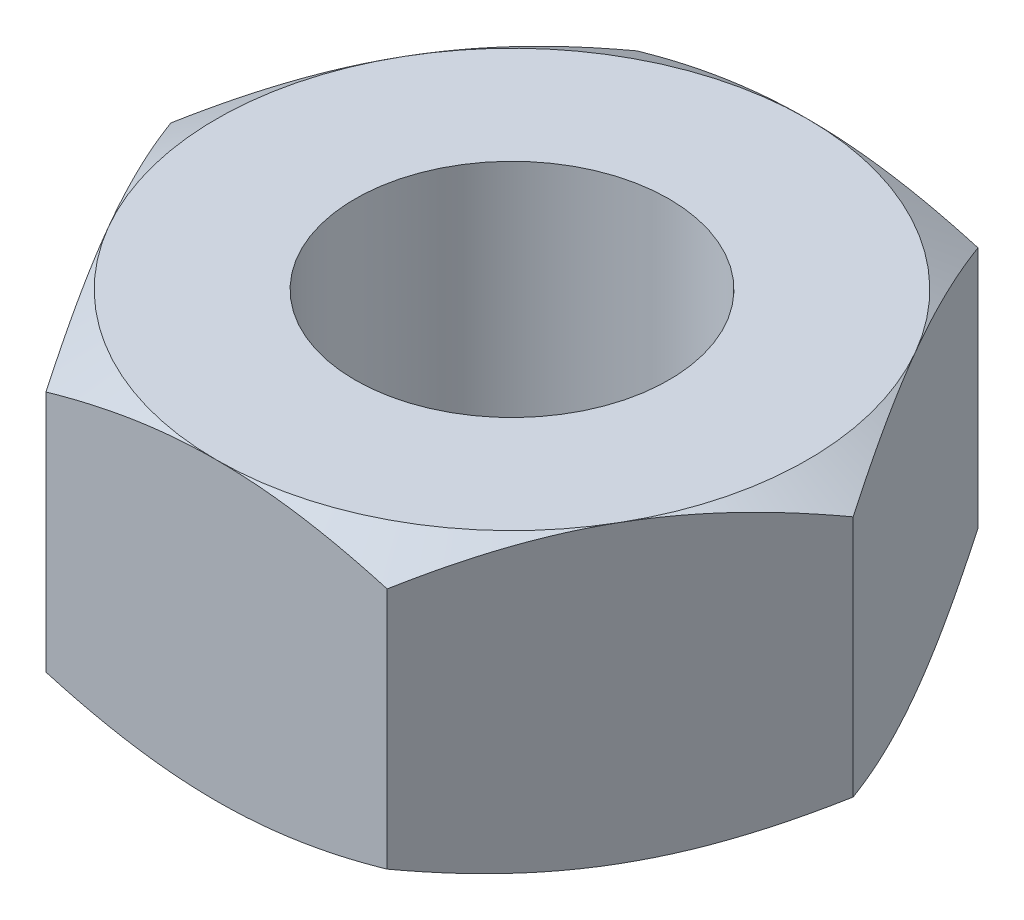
SolidWorks part; units mm, degrees
ref_plane "Front" through (0, 0, 0) normal (0, 0, 1) x (1, 0, 0)
ref_plane "Top" through (0, 0, 0) normal (0, 1, 0) x (1, 0, 0)
ref_plane "Right" through (0, 0, 0) normal (1, 0, 0) x (0, 0, -1)
sketch "Sketch1" plane through (0, 0, 0) normal (0, 1, 0) x (1, 0, 0)
  line L1 (9.2376, 0) -> (4.6188, 8)
  line L2 (4.6188, 8) -> (-4.6188, 8)
  line L3 (-4.6188, 8) -> (-9.2376, 0)
  line L4 (-9.2376, 0) -> (-4.6188, -8)
  line L5 (-4.6188, -8) -> (4.6188, -8)
  line L6 (4.6188, -8) -> (9.2376, 0)
  circle A0 centre (0, 0) radius 8 construction
  dimension "D1" = 16
extrude "Boss-Extrude1" add sketch "Sketch1" along normal blind 8
hole_wizard "M10x1.5 Tapped Hole1" positions "Sketch3" profile "Sketch4" tap size "M10x1.5" standard "ANSI Metric"
sketch "Sketch3" plane through (0, 8, 0) normal (0, 1, 0) x (1, 0, 0)
  point P0 (0, 0)
sketch "Sketch4" plane through (0, 8, 0) normal (1, 0, 0) x (0, 0, 1)
  line L0 (0, 0) -> (0, 8)
  line L1 (0, 8) -> (4.25, 8)
  line L2 (4.25, 8) -> (4.25, 0)
  line L5 (4.25, 0) -> (0, 0)
  line L11 (0, -6.35) -> (0, 107.95) construction
  dimension "Thru Tap Drill Dia." = 8.5
  dimension "Thru Tap Drill Depth" = 8
sketch "Sketch5" plane through (0, 8, 0) normal (0, 1, 0) x (1, 0, 0)
  line L0 (4.6188, -8) -> (9.2376, 0) construction
  circle A0 centre (0, 0) radius 8
extrude "Cut-Extrude1" cut sketch "Sketch5" against normal blind 7 draft 60 flip side to cut
sketch "Sketch6" plane through (0, 0, 0) normal (0, -1, 0) x (1, 0, 0)
  circle A0 centre (0, 0) radius 8
extrude "Cut-Extrude2" cut sketch "Sketch6" against normal blind 7 draft 60 flip side to cut
